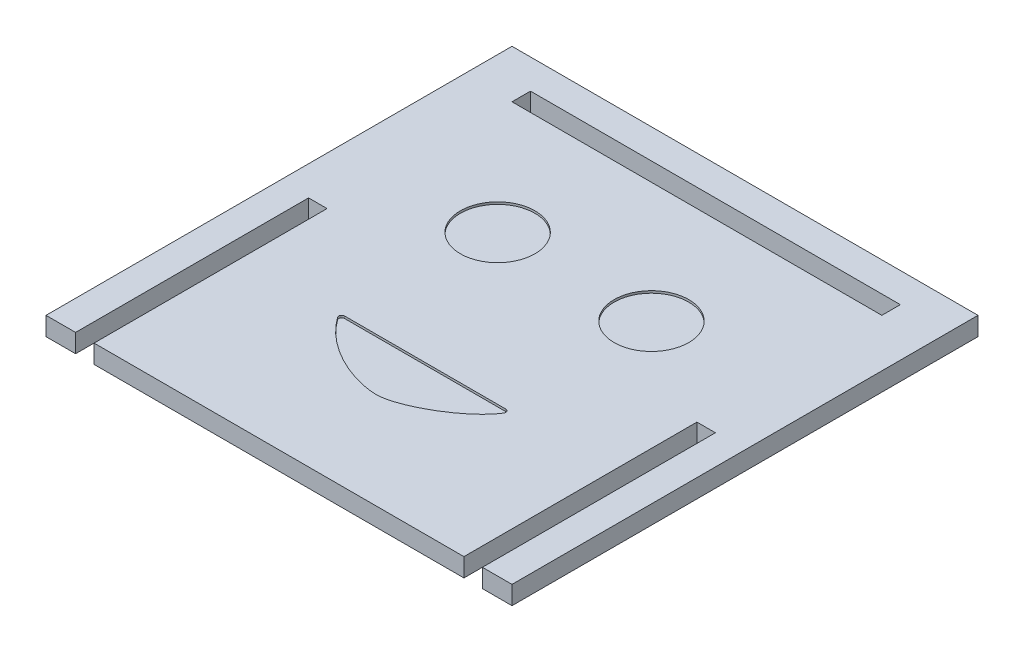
SolidWorks part; units mm, degrees
ref_plane "Front Plane" through (0, 0, 0) normal (0, 0, 1) x (1, 0, 0)
ref_plane "Top Plane" through (0, 0, 0) normal (0, 1, 0) x (1, 0, 0)
ref_plane "Right Plane" through (0, 0, 0) normal (1, 0, 0) x (0, 0, -1)
sketch "Sketch1" plane through (0, 0, 0) normal (0, 1, 0) x (1, 0, 0)
  line L0 (-27.5, -31.5) -> (-27.5, 0)
  line L1 (-31.5, 31.5) -> (31.5, 31.5)
  line L2 (-31.5, 31.5) -> (-31.5, -31.5)
  line L3 (-31.5, -31.5) -> (-27.5, -31.5)
  line L4 (31.5, 31.5) -> (31.5, -31.5)
  line L5 (-31.5, 31.5) -> (31.5, -31.5) construction
  line L6 (-31.5, -31.5) -> (31.5, 31.5) construction
  line L7 (-27.5, 0) -> (-25, 0)
  line L8 (-25, 0) -> (-25, -31.5)
  line L9 (0, 31.5) -> (0, -31.5) construction
  line L10 (27.5, -31.5) -> (27.5, 0)
  line L11 (27.5, 0) -> (25, 0)
  line L12 (25, 0) -> (25, -31.5)
  line L13 (-25, -31.5) -> (25, -31.5)
  line L14 (27.5, -31.5) -> (31.5, -31.5)
  point P0 (0, 0)
  dimension "D1" = 63
  dimension "D2" = 63
  dimension "D3" = 2.5
  dimension "D4" = 4
extrude "Boss-Extrude1" add sketch "Sketch1" along normal blind 2.5
sketch "Sketch2" plane through (0, 2.5, 0) normal (0, 1, 0) x (1, 0, 0)
  line L0 (-11.2362, -11.3923) -> (10.5434, -11.3923)
  circle A0 centre (-10.6941, 8.7551) radius 5.0413
  circle A1 centre (10.1003, 8.7551) radius 5.0413
  arc A2 (10.5434, -11.3923) -> (10.8842, -12.0018) centre (10.5434, -11.7923) cw
  arc A3 (-11.2362, -11.3923) -> (-11.5608, -12.0262) centre (-11.2362, -11.7923) ccw
  spline S0 degree 3 poles (-11.5608, -12.0262) (-8.7109, -15.9807) (-3.1268, -18.3729) (2.8026, -18.585) (9.1378, -14.8432) (10.8842, -12.0018) knots 0.023095 0.023095 0.023095 0.023095 0.468251 0.563083 0.971418 0.971418 0.971418 0.971418
  dimension "D1" = 0.4
extrude "Cut-Extrude1" cut sketch "Sketch2" against normal blind 0.3
sketch "Sketch3" plane through (0, 2.5, 0) normal (0, 1, 0) x (1, 0, 0)
  line L0 (-31.5, 31.5) -> (-31.5, -31.5) construction
  line L1 (-25, 25) -> (25, 25)
  line L2 (-25, 25) -> (-25, 27.5)
  line L3 (-25, 27.5) -> (25, 27.5)
  line L4 (25, 25) -> (25, 27.5)
  line L5 (31.5, -31.5) -> (31.5, 31.5) construction
  line L6 (31.5, 31.5) -> (-31.5, 31.5) construction
  dimension "D1" = 6.5
  dimension "D2" = 6.5
  dimension "D3" = 4
  dimension "D4" = 2.5
extrude "Cut-Extrude2" cut sketch "Sketch3" against normal through all
